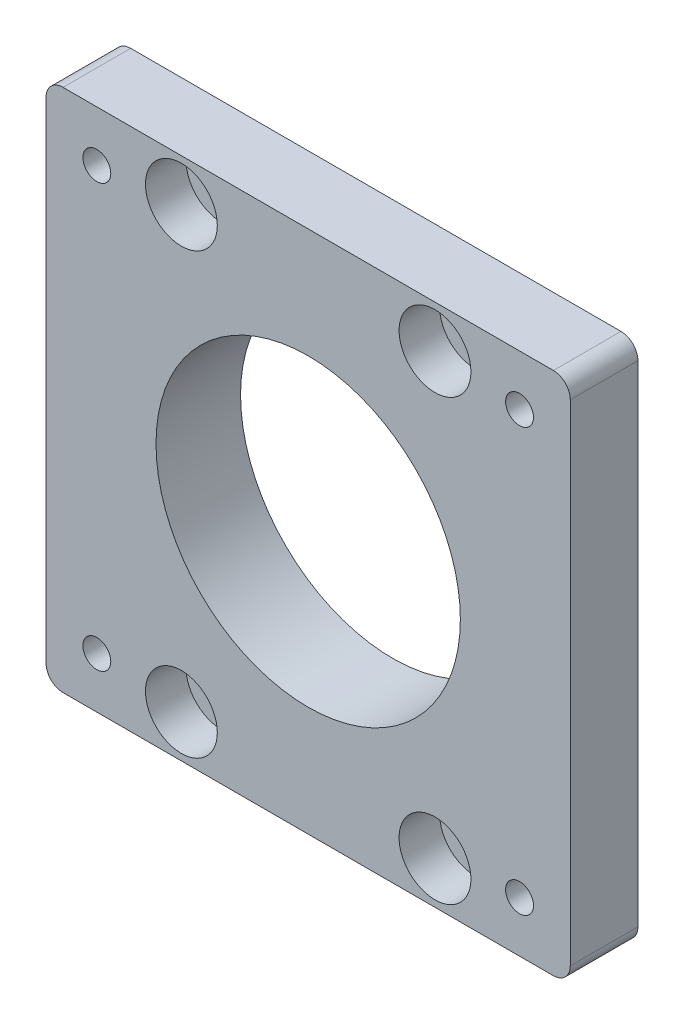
SolidWorks part; units mm, degrees
ref_plane "前视基准面" through (0, 0, 0) normal (0, 0, 1) x (1, 0, 0)
ref_plane "上视基准面" through (0, 0, 0) normal (0, 1, 0) x (1, 0, 0)
ref_plane "右视基准面" through (0, 0, 0) normal (1, 0, 0) x (0, 0, -1)
sketch "草图1" plane through (0, 0, 0) normal (0, 0, 1) x (1, 0, 0)
  line L1 (-31, -31) -> (31, -31)
  line L2 (-31, -31) -> (-31, 31)
  line L3 (-31, 31) -> (31, 31)
  line L4 (31, -31) -> (31, 31)
  line L5 (-31, -31) -> (31, 31) construction
  line L6 (-31, 31) -> (31, -31) construction
  circle A0 centre (0, 0) radius 18
  point P0 (0, 0)
  dimension "D3" = 36
  dimension "D1" = 62
  dimension "D2" = 62
extrude "凸台-拉伸1" add sketch "草图1" along normal blind 8
sketch "草图2" plane through (0, 0, 8) normal (0, 0, 1) x (1, 0, 0)
  line L0 (0, 31) -> (0, 0) construction
  line L1 (31, 31) -> (-31, 31) construction
  line L2 (0, 0) -> (-31, 0) construction
  line L3 (-31, 31) -> (-31, -31) construction
  circle A0 centre (-25, 25) radius 1.25
  circle A1 centre (25, 25) radius 1.25
  circle A2 centre (25, -25) radius 1.25
  circle A3 centre (-25, -25) radius 1.25
  dimension "D1" = 50
  dimension "D2" = 50
  dimension "D3" = 2.5
extrude "切除-拉伸1" cut sketch "草图2" against normal through all
sketch "草图5" plane through (0, 0, 8) normal (0, 0, 1) x (1, 0, 0)
  line L0 (0, 30) -> (0, 0) construction
  line L1 (0, 0) -> (-30, 0) construction
  line L2 (-15, 25.9808) -> (15, -25.9808) construction
  line L3 (15, 25.9808) -> (-15, -25.9808) construction
  circle A0 centre (0, 0) radius 30 construction
  circle A1 centre (-15, 25.9808) radius 2.25
  circle A2 centre (15, 25.9808) radius 2.25
  circle A3 centre (15, -25.9808) radius 2.25
  circle A4 centre (-15, -25.9808) radius 2.25
  dimension "D3" = 60
  dimension "D4" = 4.5
  dimension "D1" = 30
  dimension "D2" = 30
extrude "切除-拉伸3" cut sketch "草图5" against normal through all
sketch "草图6" plane through (0, 0, 8) normal (0, 0, 1) x (1, 0, 0)
  circle A0 centre (-15, 25.9808) radius 4.25
  circle A1 centre (15, 25.9808) radius 4.25
  circle A2 centre (15, -25.9808) radius 4.25
  circle A3 centre (-15, -25.9808) radius 4.25
  dimension "D1" = 8.5
extrude "切除-拉伸4" cut sketch "草图6" against normal blind 4.8
fillet "圆角1" radius 2 4 edges at (-31, 31, 4) (-31, -31, 4) (31, -31, 4) (31, 31, 4)
sketch "草图7" plane through (0, 0, 0) normal (0, 0, -1) x (-1, 0, 0)
  circle A0 centre (0, 0) radius 18 construction
  circle A1 centre (0, 0) radius 18
  circle A2 centre (0, 0) radius 25
  dimension "D1" = 50
extrude "凸台-拉伸2" add sketch "草图7" along normal blind 2
hole_wizard "M4 螺纹孔1" positions "草图9" profile "草图8" tap size "M4" standard "GB"
sketch "草图9" plane through (0, 0, 8) normal (0, 0, 1) x (1, 0, 0)
  point P0 (-25, 25)
  point P3 (-25, -25)
  point P6 (25, -25)
  point P9 (25, 25)
sketch "草图8" plane through (-25, 25, 8) normal (1, 0, 0) x (0, -1, 0)
  line L0 (0, 0) -> (0, 14.3914)
  line L1 (0, 14.3914) -> (1.65, 13.4)
  line L2 (1.65, 13.4) -> (1.65, 0)
  line L5 (1.65, 0) -> (0, 0)
  line L10 (0, 14.3914) -> (-1.65, 13.4) construction
  line L11 (0, -6.35) -> (0, 107.95) construction
  dimension "螺纹孔钻头直径" = 3.3
  dimension "螺纹孔钻头深度" = 13.4
  dimension "导头角度" = 118
